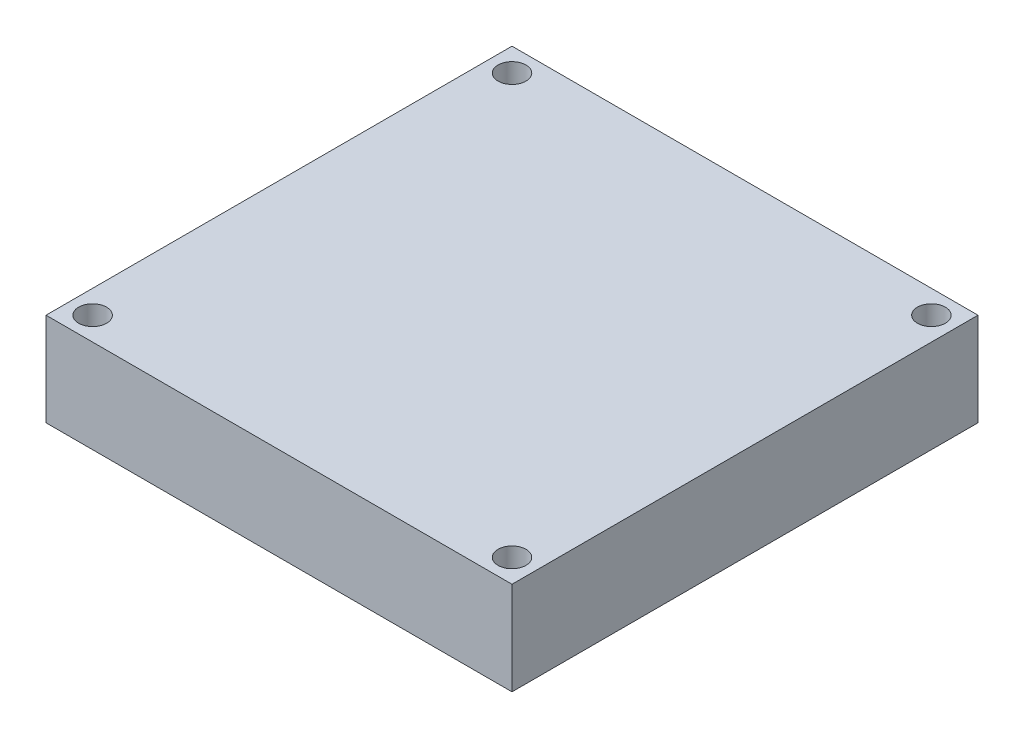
SolidWorks part; units mm, degrees
ref_plane "Alzado" through (0, 0, 0) normal (0, 0, 1) x (1, 0, 0)
ref_plane "Planta" through (0, 0, 0) normal (0, 1, 0) x (1, 0, 0)
ref_plane "Vista lateral" through (0, 0, 0) normal (1, 0, 0) x (0, 0, -1)
sketch "Croquis1" plane through (0, 0, 0) normal (0, 1, 0) x (1, 0, 0)
  line L1 (25, 25) -> (-25, 25)
  line L2 (25, 25) -> (25, -25)
  line L3 (25, -25) -> (-25, -25)
  line L4 (-25, 25) -> (-25, -25)
  line L5 (25, 25) -> (-25, -25) construction
  line L6 (25, -25) -> (-25, 25) construction
  point P0 (0, 0)
  dimension "D1" = 50
  dimension "D2" = 50
extrude "Saliente-Extruir1" add sketch "Croquis1" along normal blind 10
sketch "Croquis3" plane through (0, 10, 0) normal (0, 1, 0) x (-1, 0, 0)
  line L0 (22.5, -21.7725) -> (22.5, 11.3897) construction
  line L1 (25, -25) -> (25, 25) construction
  line L2 (125, -22.5) -> (58.7339, -22.5) construction
  line L3 (-25, -25) -> (25, -25) construction
  line L4 (-22.5, -125) -> (-22.5, -107.9691) construction
  line L5 (-25, 25) -> (-25, -25) construction
  line L6 (25, 22.5) -> (-24.3629, 22.5) construction
  line L7 (25, 25) -> (-25, 25) construction
  circle A0 centre (22.5, -22.5) radius 1.5
  circle A1 centre (-22.5, -22.5) radius 1.5
  circle A2 centre (22.5, 22.5) radius 1.5
  circle A3 centre (-22.5, 22.5) radius 1.5
  point P16 (22.5, 22.5)
  point P17 (-22.5, 22.5)
  point P18 (22.5, -22.5)
  point P19 (-22.5, -22.5)
  dimension "D1" = 2.5
  dimension "D2" = 2.5
  dimension "D3" = 2.5
  dimension "D4" = 2.5
extrude "Cortar-Extruir4" cut sketch "Croquis3" against normal blind 10
